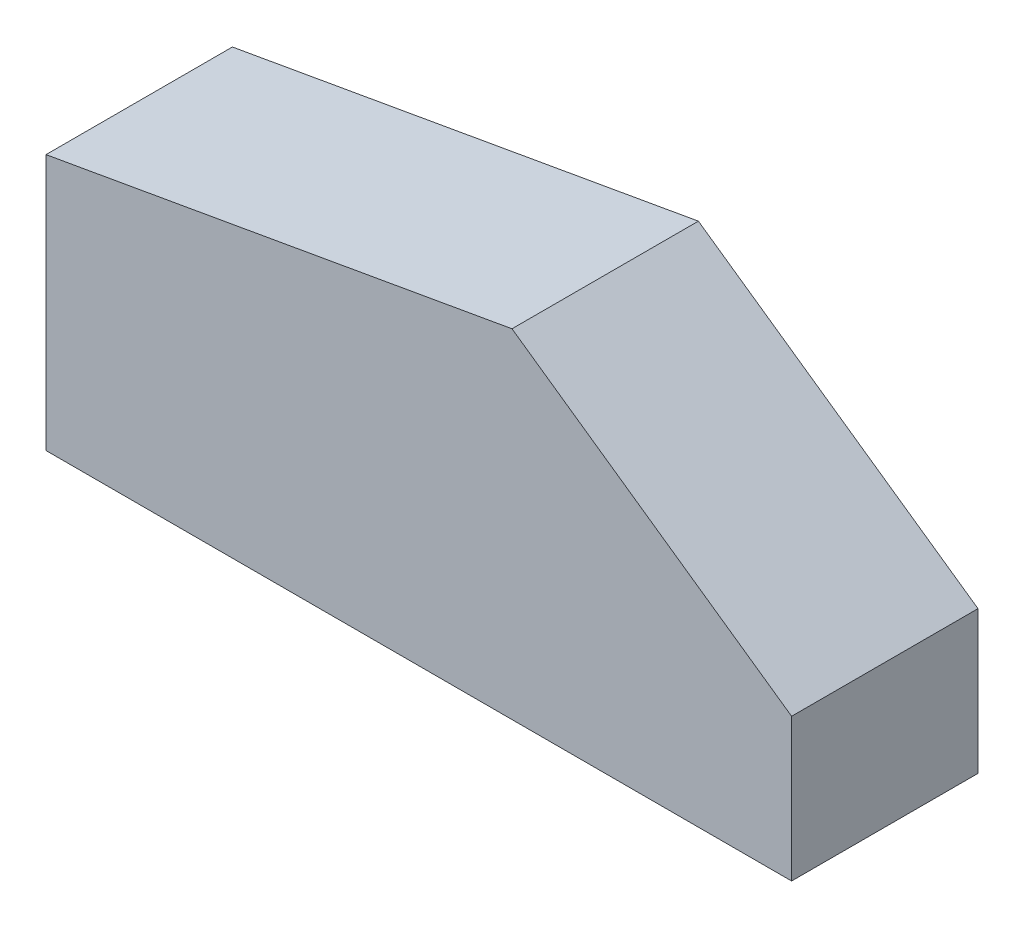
SolidWorks part; units mm, degrees
ref_plane "Front Plane" through (0, 0, 0) normal (0, 0, 1) x (1, 0, 0)
ref_plane "Top Plane" through (0, 0, 0) normal (0, 1, 0) x (1, 0, 0)
ref_plane "Right Plane" through (0, 0, 0) normal (1, 0, 0) x (0, 0, -1)
sketch "Sketch1" plane through (0, 0, 0) normal (0, 0, 1) x (1, 0, 0)
  line L0 (0, 0) -> (101.6, 0)
  line L1 (101.6, 0) -> (101.6, 19.4439)
  line L2 (101.6, 19.4439) -> (63.5, 46.1218)
  line L3 (63.5, 46.1218) -> (0, 34.925)
  line L4 (0, 34.925) -> (0, 0)
  dimension "D1" = 101.6
  dimension "D2" = 34.925
  dimension "D3" = 63.5
  dimension "D4" = 100
  dimension "D5" = 135
extrude "Extrude1" add sketch "Sketch1" along normal blind 25.4
